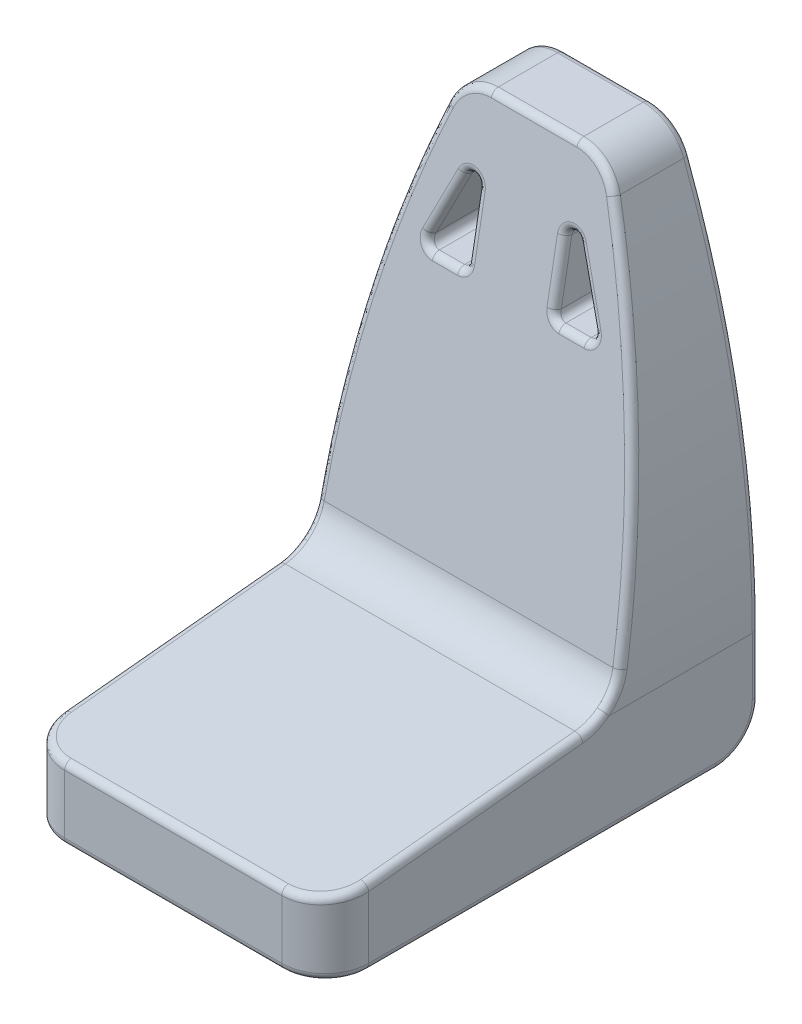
SolidWorks part; units mm, degrees
ref_plane "正面" through (0, 0, 0) normal (0, 0, 1) x (1, 0, 0)
ref_plane "平面" through (0, 0, 0) normal (0, 1, 0) x (1, 0, 0)
ref_plane "右側面" through (0, 0, 0) normal (1, 0, 0) x (0, 0, -1)
sketch "ｽｹｯﾁ2" plane through (0, 0, 0) normal (0, 1, 0) x (1, 0, 0)
  line L0 (-10.5, -15) -> (10.5, 15) construction
  line L1 (-10.5, 15) -> (10.5, 15)
  line L2 (-10.5, 15) -> (-10.5, -15)
  line L3 (-10.5, -15) -> (10.5, -15)
  line L4 (10.5, 15) -> (10.5, -15)
  dimension "D1" = 21
  dimension "D2" = 30
extrude "押し出し1" add sketch "ｽｹｯﾁ2" along normal blind 35
sketch "ｽｹｯﾁ3" plane through (10.5, 0, 0) normal (1, 0, 0) x (0, 0, -1)
  line L0 (10, 35) -> (5, 7)
  line L1 (5, 7) -> (-15, 5)
  line L2 (-15, 35) -> (-15, 0) construction
  line L3 (-15, 35) -> (15, 35) construction
  line L4 (-15, 0) -> (15, 0) construction
  line L5 (15, 35) -> (15, 0) construction
  line L6 (-15, 5) -> (-15, 35)
  line L7 (-15, 35) -> (10, 35)
  dimension "D1" = 5
  dimension "D2" = 5
  dimension "D3" = 20
  dimension "D4" = 7
extrude "ｶｯﾄ - 押し出し4" cut sketch "ｽｹｯﾁ3" against normal through all
sketch "ｽｹｯﾁ4" plane through (0, 0, 15) normal (0, 0, 1) x (1, 0, 0)
  line L0 (0, 0) -> (0, 35) construction
  line L1 (-10.5, 35) -> (10.5, 35) construction
  line L2 (-10.5, 0) -> (-10.5, 7)
  line L3 (-10.5, 5) -> (-10.5, 0) construction
  line L4 (-10.5, 0) -> (10.5, 0) construction
  line L5 (-10.5, 7) -> (-10.5, 35) construction
  line L6 (10.5, 0) -> (10.5, 7)
  line L7 (-5, 35) -> (5, 35)
  line L8 (-10.5, 0) -> (10.5, 0)
  arc A0 (-10.5, 7) -> (-5, 35) centre (63.5227, 7) cw
  arc A1 (10.5, 7) -> (5, 35) centre (-63.5227, 7) ccw
  dimension "D1" = 7
  dimension "D2" = 10
extrude "ｶｯﾄ - 押し出し5" cut sketch "ｽｹｯﾁ4" against normal through all flip side to cut
sketch "ｽｹｯﾁ5" plane through (0, 0, 15) normal (0, 0, 1) x (1, 0, 0)
  line L0 (0, 0) -> (0, 35) construction
  line L1 (-5, 35) -> (5, 35) construction
  line L2 (-3, 32) -> (-6, 25)
  line L3 (-6, 25) -> (-3, 25)
  line L4 (-3, 25) -> (-3, 32)
  line L5 (-10.5, 0) -> (10.5, 0) construction
  dimension "D1" = 7
  dimension "D2" = 25
  dimension "D3" = 6
  dimension "D4" = 12
extrude "ｶｯﾄ - 押し出し6" cut sketch "ｽｹｯﾁ5" against normal through all
mirror "ﾐﾗｰ1" about plane through (0, 0, 0) normal (1, 0, 0) of "ｶｯﾄ - 押し出し6"
fillet "ﾌｨﾚｯﾄ1" radius 3 6 edges at (-5, 35, -12.5) (5, 35, -12.5) (0, 7, -5) (10.5, 2.5, 15) (-10.5, 2.5, 15) (0, 0, -15)
fillet "ﾌｨﾚｯﾄ2" radius 0.5 46 edges at (10.5, 6.0372, 4.6281) (10.5, 0.8787, -14.1213) (0, 35, -10) (-9.0981, 21.3383, -7.5604) (9.0981, 21.3383, -7.5604) (4.6622, 34.4666, -9.9047) (-4.6622, 34.4666, -9.9047) (0, 5, 15) (-9.6213, 5.0879, 14.1213) (9.6213, 5.0879, 14.1213) (10.4888, 8.2849, -5.0579) (10.5, 6.8538, -3.1916) (-10.5, 6.8538, -3.1916) (-10.498, 7.545, -4.4692) (-10.5, 5, -15) (10.5, 5, -15) (9.306, 20.2416, -15) (-4.5, 28.5, -8.8393) (-4.5, 25, -8.2143) (-3, 28.5, -8.8393) (-3, 32, -12.2321) (-3, 28.5, -15) (-3, 25, -11.6071) (-4.5, 25, -15) (-6, 25, -11.6071) (-4.5, 28.5, -15) (4.5, 25, -8.2143) (4.5, 28.5, -8.8393) (3, 28.5, -8.8393) (3, 25, -11.6071) (3, 32, -12.2321) (6, 25, -11.6071) (3, 28.5, -15) (4.5, 28.5, -15) (4.5, 25, -15) (-9.306, 20.2416, -15) (0, 35, -15) (4.6622, 34.4666, -15) (-4.6622, 34.4666, -15) (-10.5, 0, 0) (-10.5, 6.0372, 4.6281) (-10.5, 0.8787, -14.1213) (10.5, 0, 0) (0, 0, 15) (-9.6213, 0, 14.1213) (9.6213, 0, 14.1213)
sketch "ｽｹｯﾁ6" plane through (0, 0, 0) normal (0, -1, 0) x (1, 0, 0)
  line L0 (0, 15) -> (0, 8) construction
  line L1 (-2.5, 8) -> (2.5, 8)
  line L2 (-2.5, 8) -> (-2.5, 3)
  line L3 (-2.5, 3) -> (2.5, 3)
  line L4 (2.5, 8) -> (2.5, 3)
  line L5 (-7.5, 15) -> (7.5, 15) construction
  dimension "D1" = 5
  dimension "D2" = 7
extrude "ｶｯﾄ - 押し出し7" cut sketch "ｽｹｯﾁ6" against normal blind 2
